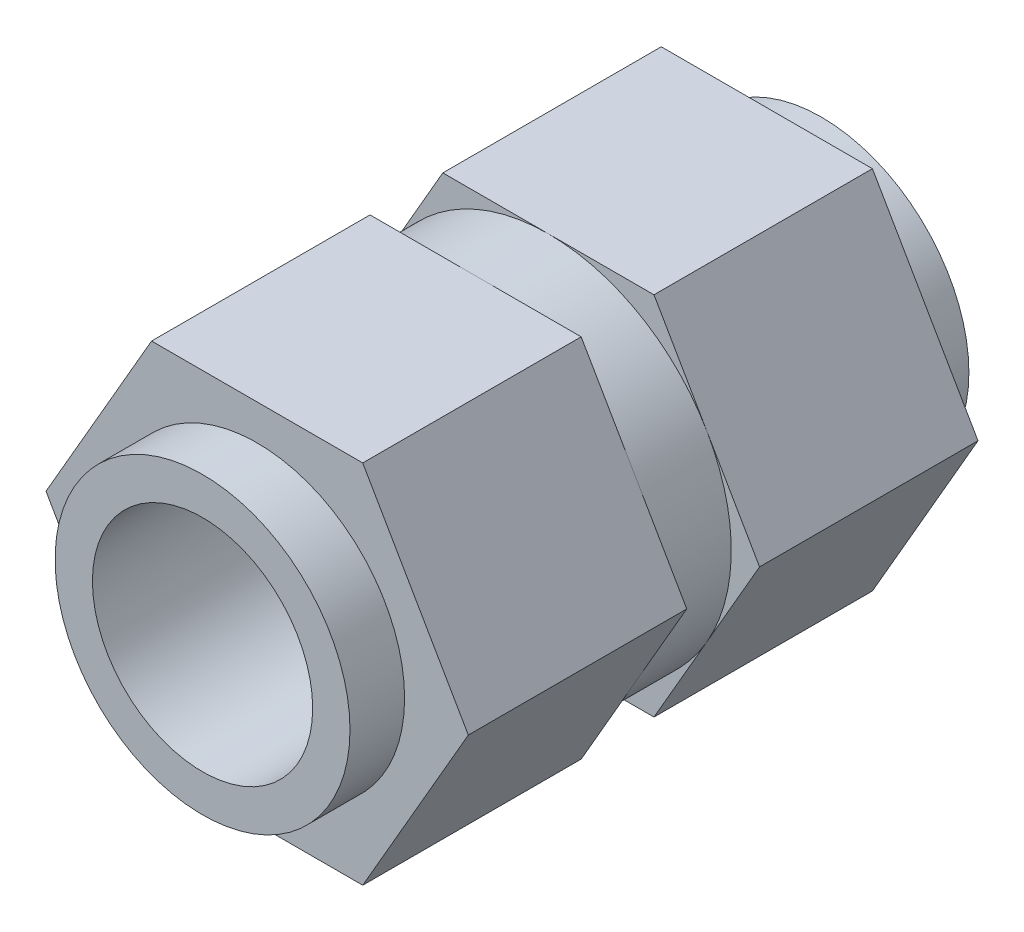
SolidWorks part; units mm, degrees
ref_plane "Front Plane" through (0, 0, 0) normal (0, 0, 1) x (1, 0, 0)
ref_plane "Top Plane" through (0, 0, 0) normal (0, 1, 0) x (1, 0, 0)
ref_plane "Right Plane" through (0, 0, 0) normal (1, 0, 0) x (0, 0, -1)
sketch "Sketch1" plane through (0, 0, 0) normal (0, 0, 1) x (1, 0, 0)
  line L1 (5.8, 0) -> (2.9, 5.0229)
  line L2 (2.9, 5.0229) -> (-2.9, 5.0229)
  line L3 (-2.9, 5.0229) -> (-5.8, 0)
  line L4 (-5.8, 0) -> (-2.9, -5.0229)
  line L5 (-2.9, -5.0229) -> (2.9, -5.0229)
  line L6 (2.9, -5.0229) -> (5.8, 0)
  circle A0 centre (0, 0) radius 5.0229 construction
  dimension "D1" = 11.6
extrude "Boss-Extrude1" add sketch "Sketch1" along normal blind 6
sketch "Sketch3" plane through (0, 0, 6) normal (0, 0, 1) x (1, 0, 0)
  circle A0 centre (0, 0) radius 5.0229
  dimension "D1" = 10.0459
extrude "Boss-Extrude2" add sketch "Sketch3" along normal blind 2
sketch "Sketch4" plane through (0, 0, 8) normal (0, 0, 1) x (1, 0, 0)
  line L1 (-5.8, 0) -> (-2.9, -5.0229)
  line L2 (-2.9, -5.0229) -> (2.9, -5.0229)
  line L3 (2.9, -5.0229) -> (5.8, 0)
  line L4 (5.8, 0) -> (2.9, 5.0229)
  line L5 (2.9, 5.0229) -> (-2.9, 5.0229)
  line L6 (-2.9, 5.0229) -> (-5.8, 0)
  circle A0 centre (0, 0) radius 5.0229 construction
  dimension "D1" = 11.6
extrude "Boss-Extrude3" add sketch "Sketch4" along normal blind 6
sketch "Sketch5" plane through (0, 0, 0) normal (0, 0, -1) x (-1, 0, 0)
  circle A0 centre (0, 0) radius 4.05
  dimension "D1" = 8.1
extrude "Boss-Extrude4" add sketch "Sketch5" along normal blind 1.5
sketch "Sketch6" plane through (0, 0, -1.5) normal (0, 0, -1) x (-1, 0, 0)
  circle A0 centre (0, 0) radius 2.5
  dimension "D1" = 5
extrude "Cut-Extrude1" cut sketch "Sketch6" against normal blind 1
sketch "Sketch7" plane through (0, 0, -0.5) normal (0, 0, -1) x (-1, 0, 0)
  circle A0 centre (0, 0) radius 1.5
  dimension "D1" = 3
extrude "Cut-Extrude2" cut sketch "Sketch7" against normal blind 1.75
sketch "Sketch8" plane through (0, 0, 14) normal (0, 0, 1) x (1, 0, 0)
  circle A0 centre (0, 0) radius 3.025
  dimension "D1" = 6.05
extrude "Cut-Extrude3" cut sketch "Sketch8" against normal up to surface (12.75 mm away)
sketch "Sketch9" plane through (0, 0, 14) normal (0, 0, 1) x (1, 0, 0)
  circle A0 centre (0, 0) radius 4.05
  circle A1 centre (0, 0) radius 3.025
  dimension "D1" = 8.1
  dimension "D2" = 6.05
extrude "Boss-Extrude5" add sketch "Sketch9" along normal blind 1.5
